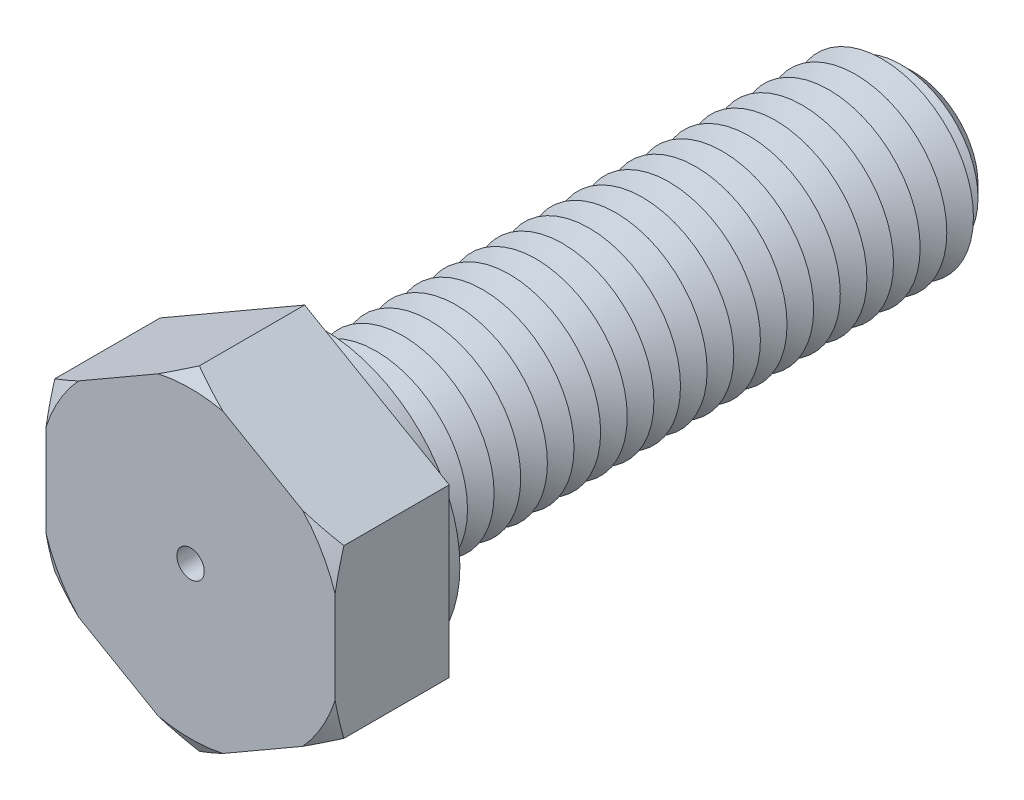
SolidWorks part; units mm, degrees
ref_plane "Front Plane" through (0, 0, 0) normal (0, 0, 1) x (1, 0, 0)
ref_plane "Top Plane" through (0, 0, 0) normal (0, 1, 0) x (1, 0, 0)
ref_plane "Right Plane" through (0, 0, 0) normal (1, 0, 0) x (0, 0, -1)
sketch "Sketch2" plane through (0, 0, 0) normal (0, 0, 1) x (1, 0, 0)
  line L1 (0, 10.9697) -> (-9.5, 5.4848)
  line L2 (-9.5, 5.4848) -> (-9.5, -5.4848)
  line L3 (-9.5, -5.4848) -> (0, -10.9697)
  line L4 (0, -10.9697) -> (9.5, -5.4848)
  line L5 (9.5, -5.4848) -> (9.5, 5.4848)
  line L6 (9.5, 5.4848) -> (0, 10.9697)
  circle A0 centre (0, 0) radius 9.5 construction
  dimension "D1" = 19
extrude "Boss-Extrude1" add sketch "Sketch2" along normal blind 7.5
sketch "Sketch3" plane through (0, 0, 0) normal (0, 0, -1) x (-1, 0, 0)
  circle A0 centre (0, 0) radius 6
  dimension "D1" = 12
extrude "Boss-Extrude2" add sketch "Sketch3" along normal blind 40
sketch "Sketch4" plane through (0, 0, 0) normal (0, 0, -1) x (-1, 0, 0)
  circle A0 centre (0, 0) radius 9
  dimension "D1" = 18
extrude "Boss-Extrude3" add sketch "Sketch4" along normal blind 1.2
sketch "Sketch5" plane through (0, 0, 0) normal (1, 0, 0) x (0, 0, -1)
  line L0 (-3.2117, 0) -> (6.3192, 0) construction
chamfer "Chamfer1" distance 1.75 angle 45 1 edges at (-6, 0, -40)
sketch "Sketch6" plane through (0, 0, 0) normal (1, 0, 0) x (0, 0, -1)
  line L0 (1.2, 6) -> (2.075, 4.4845)
  line L1 (2.075, 4.4845) -> (2.95, 6)
  line L2 (38.25, 6) -> (1.2, 6) construction
  line L3 (2.95, 6) -> (1.2, 6)
  dimension "D1" = 1.75
revolve "Cut-Revolve1" cut sketch "Sketch6" angle 360 about L0
pattern_linear "LPattern1" count 22 spacing 1.75 along (0, 0, -1) of "Cut-Revolve1"
sketch "Sketch7" plane through (0, 0, 0) normal (1, 0, 0) x (0, 0, -1)
  line L0 (-7.5, 10.9697) -> (-7.5, 9.9697)
  line L1 (-7.5, 5.4848) -> (-7.5, 10.9697) construction
  line L2 (-7.5, 9.9697) -> (-6.9226, 10.9697)
  line L3 (-7.5, 10.9697) -> (0, 10.9697) construction
  line L4 (-6.9226, 10.9697) -> (-7.5, 10.9697)
  dimension "D1" = 1
  dimension "D2" = 30
revolve "Cut-Revolve2" cut sketch "Sketch7" angle 360 about L0
sketch "Sketch8" plane through (0, 0, 7.5) normal (0, 0, 1) x (1, 0, 0)
  circle A0 centre (0, 0) radius 0.9
  dimension "D1" = 1.8
extrude "Cut-Extrude1" cut sketch "Sketch8" against normal up to surface (47.5 mm away)
